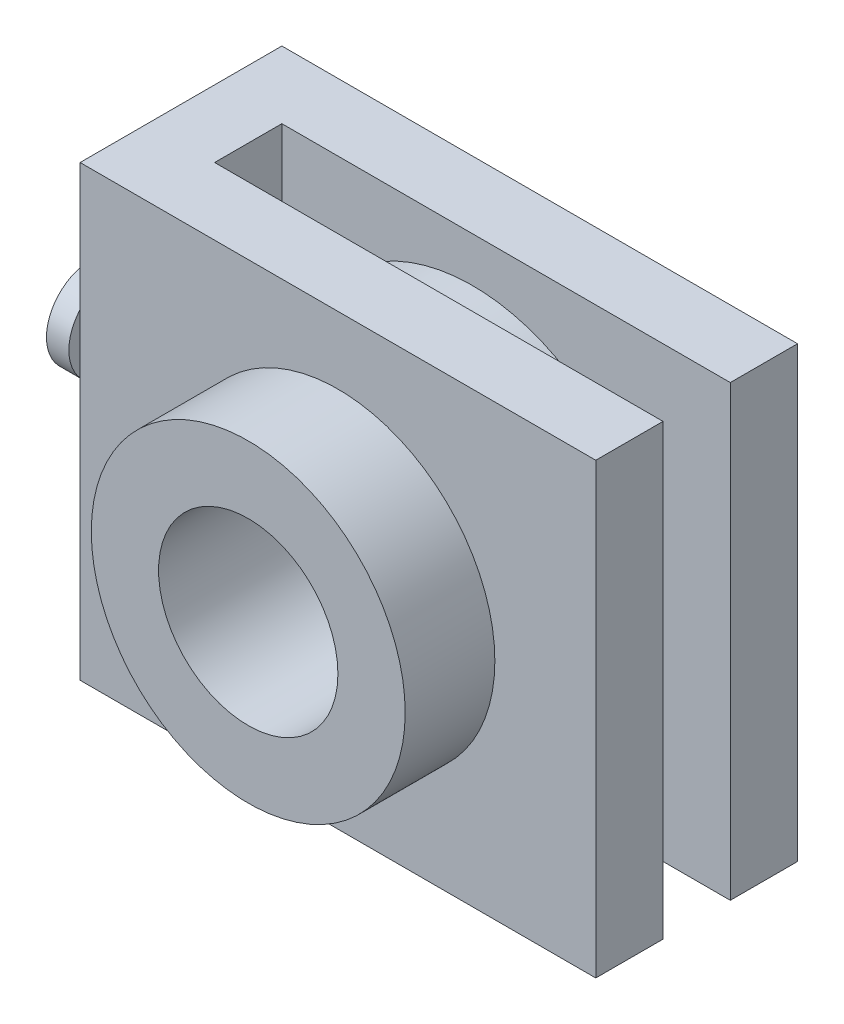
SolidWorks part; units mm, degrees
ref_plane "Front Plane" through (0, 0, 0) normal (0, 0, 1) x (1, 0, 0)
ref_plane "Top Plane" through (0, 0, 0) normal (0, 1, 0) x (1, 0, 0)
ref_plane "Right Plane" through (0, 0, 0) normal (1, 0, 0) x (0, 0, -1)
sketch "Sketch1" plane through (0, 0, 0) normal (0, 0, 1) x (1, 0, 0)
  line L1 (10, -10) -> (-10, -10)
  line L2 (10, -10) -> (10, 10)
  line L3 (10, 10) -> (-10, 10)
  line L4 (-10, -10) -> (-10, 10)
  line L5 (10, -10) -> (-10, 10) construction
  line L6 (10, 10) -> (-10, -10) construction
  point P0 (0, 0)
  dimension "D1" = 20
  dimension "D2" = 20
extrude "Boss-Extrude1" add sketch "Sketch1" along normal blind 3
sketch "Sketch2" plane through (10, 0, 0) normal (1, 0, 0) x (0, 0, -1)
  line L0 (0, -10) -> (0, 10) construction
  line L1 (6, 10) -> (3, 10)
  line L2 (6, 10) -> (6, -10)
  line L3 (6, -10) -> (3, -10)
  line L4 (3, 10) -> (3, -10)
  line L5 (6, 10) -> (3, -10) construction
  line L6 (6, -10) -> (3, 10) construction
  point P0 (4.5, 0)
  dimension "D1" = 3
  dimension "D2" = 3
extrude "Boss-Extrude2" add sketch "Sketch2" against normal blind 20 separate body
sketch "Sketch3" plane through (-10, 0, 0) normal (-1, 0, 0) x (0, 0, 1)
  line L1 (-6, 10) -> (3, 10)
  line L2 (-6, 10) -> (-6, -10)
  line L3 (-6, -10) -> (3, -10)
  line L4 (3, 10) -> (3, -10)
extrude "Boss-Extrude3" add sketch "Sketch3" along normal blind 3
sketch "Sketch4" plane through (-13, 0, 0) normal (-1, 0, 0) x (0, 0, 1)
  circle A0 centre (-1.5, 0) radius 1.5
  dimension "D1" = 3
extrude "Boss-Extrude4" add sketch "Sketch4" along normal blind 3
sketch "Sketch5" plane through (-16, 0, 0) normal (-1, 0, 0) x (0, 0, 1)
  circle A0 centre (-1.5, 0) radius 2
  dimension "D1" = 4
extrude "Boss-Extrude5" add sketch "Sketch5" along normal blind 1
sketch "Sketch6" plane through (0, 0, 3) normal (0, 0, 1) x (1, 0, 0)
  circle A0 centre (-1.5, 0) radius 7
  dimension "D1" = 14
extrude "Cut-Extrude1" cut sketch "Sketch6" against normal blind 10
sketch "Sketch7" plane through (0, 0, -3) normal (0, 0, 1) x (1, 0, 0)
  circle A2 centre (-1.5, 0) radius 8
  circle A3 centre (-1.5, 0) radius 4
  dimension "D1" = 16
  dimension "D2" = 8
extrude "Boss-Extrude7" add sketch "Sketch7" along normal up to surface (3 mm away)
sketch "Sketch8" plane through (0, 0, -3) normal (0, 0, 1) x (1, 0, 0)
  circle A0 centre (-1.5, 0) radius 4
  circle A1 centre (-1.5, 0) radius 7
  dimension "D1" = 8
  dimension "D2" = 14
extrude "Boss-Extrude8" add sketch "Sketch8" along normal blind 10
